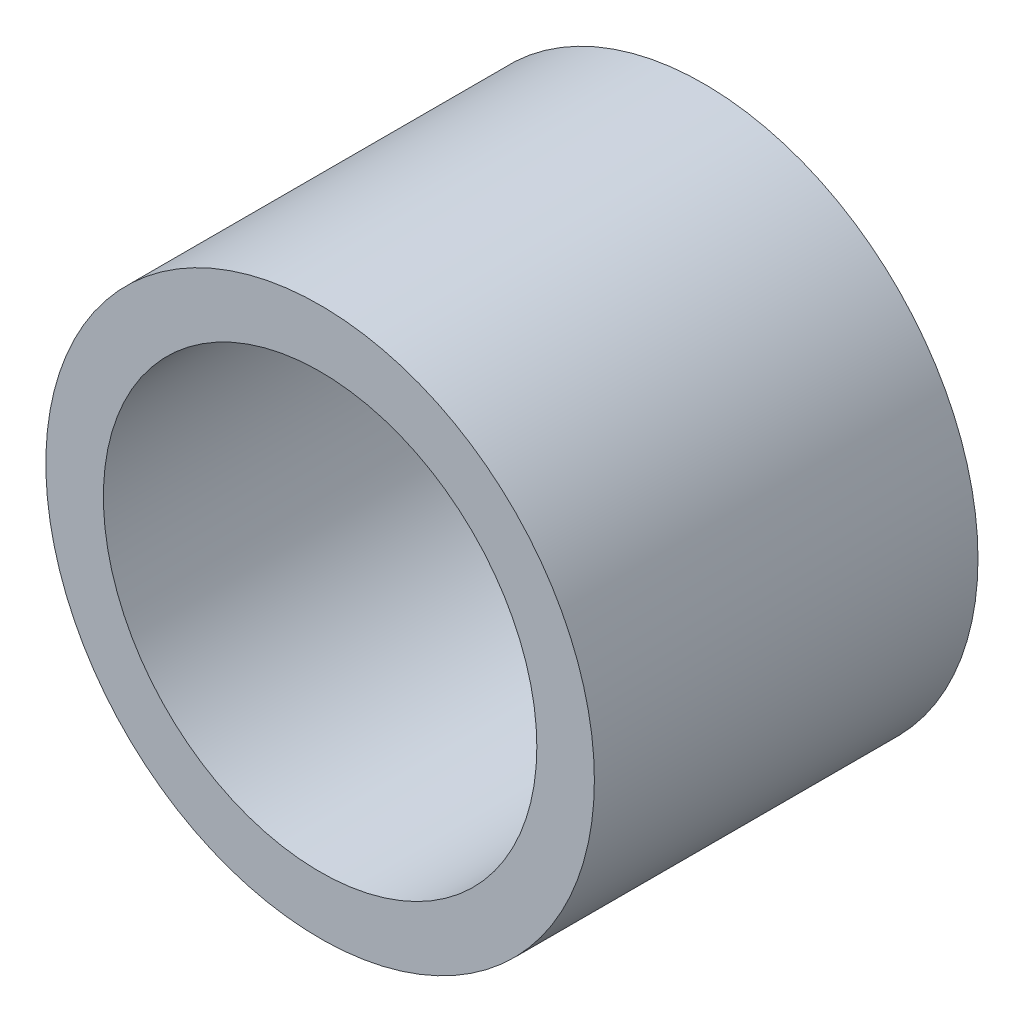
SolidWorks part; units mm, degrees
ref_plane "Face" through (0, 0, 0) normal (0, 0, 1) x (1, 0, 0)
ref_plane "Dessus" through (0, 0, 0) normal (0, 1, 0) x (1, 0, 0)
ref_plane "Droite" through (0, 0, 0) normal (1, 0, 0) x (0, 0, -1)
sketch "Esquisse1" plane through (0, 0, 0) normal (0, 0, 1) x (1, 0, 0)
  circle A0 centre (0, 0) radius 5.65
  circle A1 centre (0, 0) radius 7.15
  dimension "D1" = 14.3
  dimension "D2" = 11.3
extrude "Base-Extrusion" add sketch "Esquisse1" along normal blind 10
